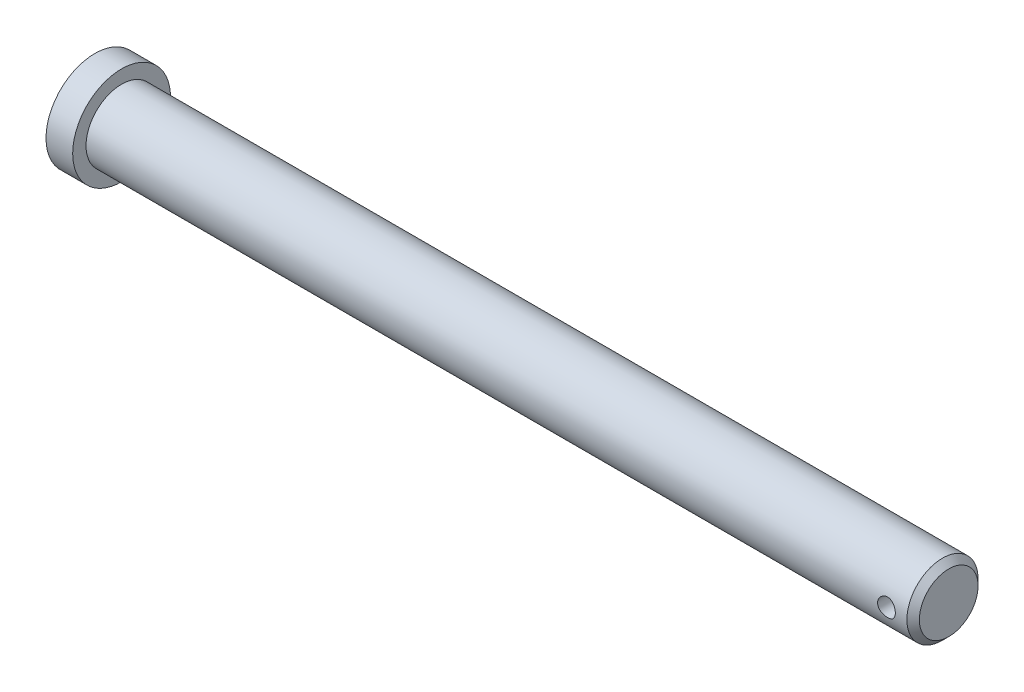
SolidWorks part; units mm, degrees
ref_plane "Спереди" through (0, 0, 0) normal (0, 0, 1) x (1, 0, 0)
ref_plane "Сверху" through (0, 0, 0) normal (0, 1, 0) x (1, 0, 0)
ref_plane "Справа" through (0, 0, 0) normal (1, 0, 0) x (0, 0, -1)
sketch "Эскиз1" plane through (0, 0, 0) normal (0, 0, 1) x (1, 0, 0)
  line L8 (0, 0) -> (0, 4)
  line L9 (0, 4) -> (-93, 4)
  line L10 (-93, 4) -> (-93, 5.5)
  line L11 (-93, 5.5) -> (-96, 5.5)
  line L12 (-96, 5.5) -> (-96, 0)
  line L13 (-96, 0) -> (0, 0)
  dimension "D1" = 5.5
  dimension "D2" = 3
  dimension "D3" = 96
  dimension "D4" = 4
revolve "Повернуть4" add sketch "Эскиз1" angle 360 about L13
sketch "Эскиз2" plane through (0, 0, 0) normal (0, 0, 1) x (1, 0, 0)
  line L0 (-93, -5.5) -> (-93, 5.5) construction
  line L2 (-98.582, 0) -> (-64.2886, 0) construction
  circle A0 centre (-3, 0) radius 1
  dimension "D1" = 2
  dimension "D2" = 90
extrude "Вырез-Вытянуть1" cut sketch "Эскиз2" against normal through all both and the other way through all
chamfer "Фаска1" distance 0.7 angle 45 1 edges at (0, 0, 4)
